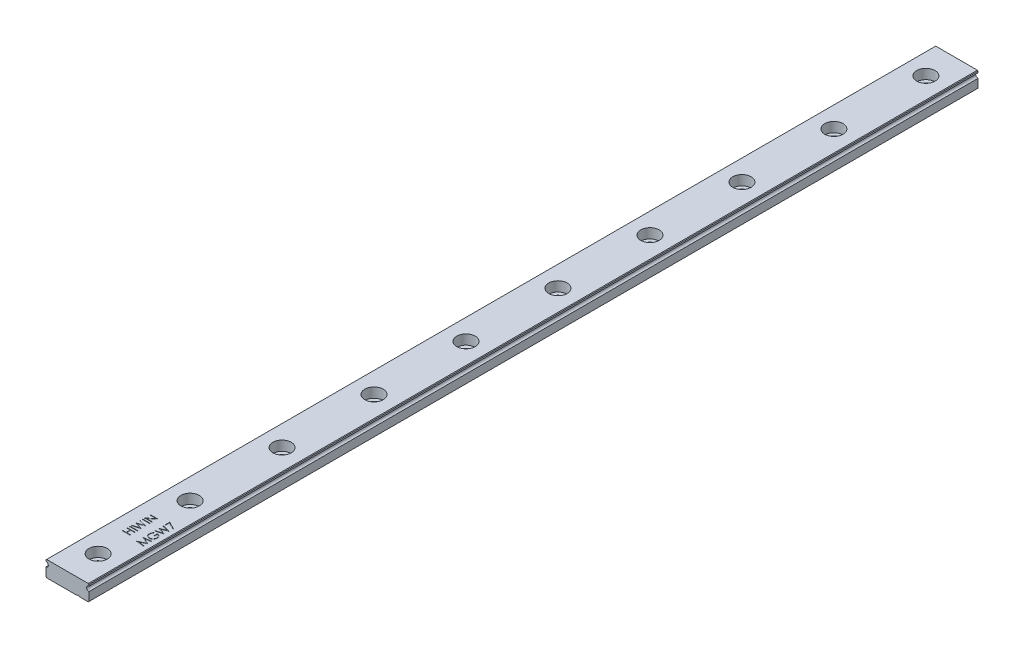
SolidWorks part; units mm, degrees
ref_plane "前视基准面" through (0, 0, 0) normal (0, 0, 1) x (1, 0, 0)
ref_plane "上视基准面" through (0, 0, 0) normal (0, 1, 0) x (1, 0, 0)
ref_plane "右视基准面" through (0, 0, 0) normal (1, 0, 0) x (0, 0, -1)
sketch "草图1" plane through (0, 0, 0) normal (0, 0, 1) x (1, 0, 0)
  line L12 (6.8, 5.2) -> (-6.8, 5.2)
  line L13 (7, 4.5) -> (7, 5)
  line L14 (-7, 0.2) -> (-6.8, 0)
  line L15 (3.8, 0) -> (6.8, 0)
  line L16 (7, 0.2) -> (7, 3)
  line L17 (0, 5.2) -> (0, 0) construction
  line L18 (-6.8, 0) -> (3.2, 0)
  line L19 (-6.8, 5.2) -> (-7, 5)
  line L20 (-7, 5) -> (-7, 4.5)
  line L21 (7, 5) -> (6.8, 5.2)
  line L22 (6.8, 0) -> (7, 0.2)
  line L23 (-7, 3) -> (-7, 0.2)
  arc A3 (-7, 3) -> (-7, 4.5) centre (-7, 3.75) ccw
  arc A4 (3.8, 0) -> (3.2, 0) centre (3.5, 0) ccw
  arc A5 (7, 4.5) -> (7, 3) centre (7, 3.75) ccw
extrude "凸台-拉伸1" add sketch "草图1" against normal blind 290
hole_wizard "M3 六角凹头螺钉的柱形沉头孔1" positions "草图3" profile "草图2" counterbore size "M3" standard "ISO"
sketch "草图3" plane through (-1.5973, 5.2, -94.5605) normal (0, 1, 0) x (-1, 0, 0)
  line L6 (-8.3973, 94.5605) -> (5.2027, 94.5605) construction
  point P15 (-1.5973, 84.5605)
  dimension "D1" = 10
sketch "草图2" plane through (0, 5.2, -10) normal (1, 0, 0) x (0, 0, 1)
  line L0 (0, 0) -> (0, 5.2)
  line L1 (0, 5.2) -> (1.75, 5.2)
  line L3 (1.75, 5.2) -> (1.75, 3.2)
  line L4 (1.75, 3.2) -> (3, 3.2)
  line L5 (3, 3.2) -> (3, 0)
  line L7 (3, 0) -> (0, 0)
  line L11 (0, -6.35) -> (0, 107.95) construction
  dimension "通孔孔直径" = 3.5
  dimension "通孔孔深度" = 5.2
  dimension "柱形沉头孔直径" = 6
  dimension "柱形沉头孔深度" = 3.2
pattern_linear "阵列(线性)1" count 10 spacing 30 along (0, 0, -1) of "M3 六角凹头螺钉的柱形沉头孔1"
sketch "草图4" plane through (0, 5.2, 0) normal (0, 1, 0) x (1, 0, 0)
  line L2 (0, 10) -> (0, 40) construction
  text T0 "HIWIN  MGW7" font "Century Gothic" height 2.5
extrude "切除-拉伸1" cut sketch "草图4" against normal blind 0.1
equation "\"D1@凸台-拉伸1\" = 2 * \"D1@草图3\" + \"D3@阵列(线性)1\" *  (\"D1@阵列(线性)1\" - 1  ) "
